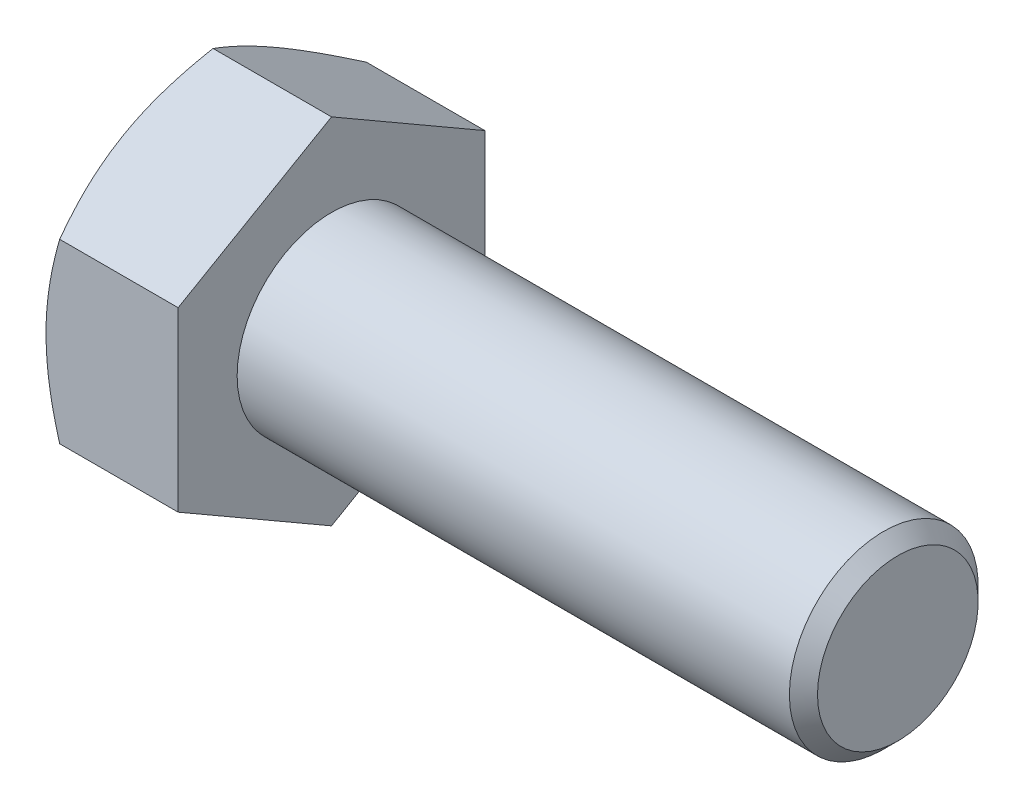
SolidWorks part; units mm, degrees
extrude "BaseHead" add sketch "Sketch1" along normal blind 17.78
sketch "Sketch1" plane through (0, 0, 0) normal (1, 0, 0) x (0, 0, -1)
  line L0 (20.6375, 11.9151) -> (20.6375, -11.9151)
  line L1 (-20.6375, 11.9151) -> (-20.6375, -11.9151)
  line L2 (20.6375, -11.9151) -> (0, -23.8301)
  line L3 (0, -23.8301) -> (-20.6375, -11.9151)
  line L4 (20.6375, 11.9151) -> (0, 23.8301)
  line L5 (0, 23.8301) -> (-20.6375, 11.9151)
ref_plane "Plane1" through (0, 0, 0) normal (0, 0, 1) x (1, 0, 0)
ref_plane "Plane2" through (0, 0, 0) normal (0, 1, 0) x (1, 0, 0)
ref_plane "Plane3" through (0, 0, 0) normal (1, 0, 0) x (0, 0, -1)
other "Configuration Table"
sketch "BodySke" plane through (0, 0, 0) normal (0, 0, 1) x (1, 0, 0)
  line L0 (0, 11.9151) -> (0, -11.9151) construction
  line L1 (0, 0) -> (93.98, 0)
  line L2 (0, 0) -> (0, 12.7)
  line L3 (0, 12.7) -> (92.0877, 12.7)
  line L4 (93.98, 0) -> (93.98, 10.8077)
  line L5 (17.78, 23.8301) -> (17.78, 11.9151) construction
  line L6 (93.98, 10.8077) -> (92.0877, 12.7)
  line L7 (0, 0) -> (96.52, 0) construction
  line L8 (93.98, -10.8077) -> (92.0877, -12.7) construction
  line L9 (0, -12.7) -> (92.0877, -12.7) construction
  line L10 (19.8882, 15.24) -> (19.8882, -3.81) construction
  line L11 (62.23, 15.24) -> (62.23, -3.81) construction
  line L12 (17.78, 11.9151) -> (17.78, -11.9151) construction
revolve "BaseBody" add sketch "BodySke" angle 360 about L7
sketch "Sketch3" plane through (0, 0, 0) normal (0, 0, 1) x (1, 0, 0)
  line L0 (0, 20.6375) -> (5.5094, 30.1801)
  line L1 (0, 23.8301) -> (0, 11.9151) construction
  line L2 (5.5094, 30.1801) -> (5.5094, 36.5301)
  line L3 (5.5094, 36.5301) -> (-12.7, 36.5301)
  line L4 (-12.7, 36.5301) -> (-12.7, 20.6375)
  line L5 (-12.7, 20.6375) -> (0, 20.6375)
  line L6 (0, 0) -> (99.06, 0) construction
  line L7 (17.78, 23.8301) -> (0, 23.8301) construction
revolve "HeadChamfer" cut sketch "Sketch3" angle 360 about L6
fillet "HeadFillet" [suppressed] radius 2.286
sketch "ThdSchSke" plane through (0, 0, 0) normal (0, 0, 1) x (1, 0, 0)
  line L0 (62.23, -10.8077) -> (60.905, -12.7)
  line L1 (62.23, -10.8077) -> (63.555, -12.7)
  line L2 (63.555, -12.7) -> (63.555, -15.875)
  line L3 (-3.175, 0) -> (5.1513, 0) construction
  line L5 (63.555, -15.875) -> (60.905, -15.875)
  line L6 (60.905, -15.875) -> (60.905, -12.7)
revolve "ThreadSchematic" [suppressed] cut sketch "ThdSchSke" angle 360 about L3
pattern_linear "ThdSchPat" [suppressed]
equation "\"D3@Sketch1\" = \"Width_flats@Sketch1\" / 2"
equation "\"D4@Sketch1\" = \"D3@Sketch1\""
equation "\"D5@Sketch1\" = \"D4@Sketch1\""
equation "\"Thread_minor@ThreadCosmetic\" = \"Minor_dia@BodySke\""
equation "\"D1@Sketch3\" = \"Width_flats@Sketch1\" / 2"
equation "\"Thread_length@ThreadCosmetic\" = ((sgn( (\"Length@BodySke\" - \"Advance@BodySke\" ) - \"Thread_nom@BodySke\" )-1)*( (\"Length@BodySke\" - \"Advance@BodySke\" ) - \"Thread_nom@BodySke\" ))/-2+ \"Thread_nom@BodySke\""
equation "\"Thread_minor@ThdSchSke\" = \"Minor_dia@BodySke\""
equation "\"Diameter@ThdSchSke\" = \"Diameter@BodySke\""
equation "\"Overcut@ThdSchSke\" = \"Diameter@BodySke\" * 1.25"
equation "\"Start@ThdSchSke\" = \"Head_ht@BaseHead\" + \"Length@BodySke\" - \"Thread_length@ThreadCosmetic\"  '---Non-countersunk---"
equation "\"Num_threads@ThdSchPat\" = int( \"Thread_length@ThreadCosmetic\" / \"Advance@BodySke\" + 0.999 )  + 1"
equation "\"Advance@ThdSchPat\" = \"Thread_length@ThreadCosmetic\" /  (\"Num_threads@ThdSchPat\" - 1) 'relax it"
equation "\"Num_threads@ThdSchPat\" = \"Num_threads@ThdSchPat\" - sgn( \"Num_threads@ThdSchPat\" - 1) '---chamfered tips only---"
